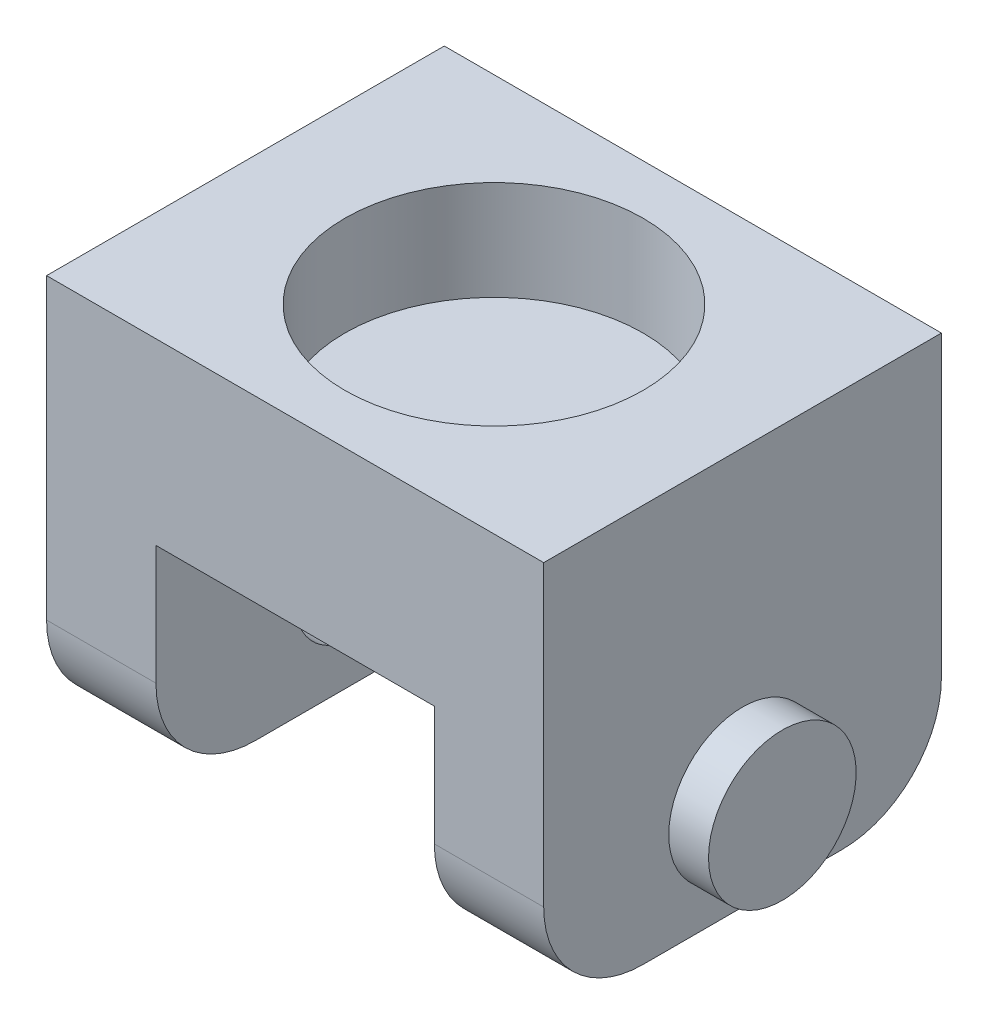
SolidWorks part; units mm, degrees
ref_plane "Alzado" through (0, 0, 0) normal (0, 0, 1) x (1, 0, 0)
ref_plane "Planta" through (0, 0, 0) normal (0, 1, 0) x (1, 0, 0)
ref_plane "Vista lateral" through (0, 0, 0) normal (1, 0, 0) x (0, 0, -1)
sketch "Croquis1" plane through (0, 0, 0) normal (0, 1, 0) x (1, 0, 0)
  line L1 (-12.5, 10) -> (12.5, 10)
  line L2 (-12.5, 10) -> (-12.5, -10)
  line L3 (-12.5, -10) -> (12.5, -10)
  line L4 (12.5, 10) -> (12.5, -10)
  line L5 (-12.5, 10) -> (12.5, -10) construction
  line L6 (-12.5, -10) -> (12.5, 10) construction
  point P0 (0, 0)
  dimension "D1" = 25
  dimension "D2" = 20
extrude "Saliente-Extruir1" add sketch "Croquis1" along normal blind 20
sketch "Croquis2" plane through (0, 20, 0) normal (0, 1, 0) x (1, 0, 0)
  circle A0 centre (0, 0) radius 7.5
  dimension "D1" = 15
extrude "Cortar-Extruir1" cut sketch "Croquis2" against normal blind 5
sketch "Croquis4" plane through (0, 0, 10) normal (0, 0, 1) x (1, 0, 0)
  line L1 (-12.5, 0) -> (12.5, 0) construction
  line L2 (-7, 11) -> (7, 11)
  line L3 (-7, 11) -> (-7, -11)
  line L4 (-7, -11) -> (7, -11)
  line L5 (7, 11) -> (7, -11)
  line L6 (-7, 11) -> (7, -11) construction
  line L7 (-7, -11) -> (7, 11) construction
  point P0 (0, 0)
  dimension "D1" = 14
  dimension "D2" = 22
extrude "Cortar-Extruir3" cut sketch "Croquis4" against normal through all
sketch "Croquis5" plane through (-12.5, 0, 0) normal (-1, 0, 0) x (0, 0, 1)
  line L0 (10, 5) -> (-10, 5) construction
  line L1 (10, 20) -> (10, 0) construction
  line L2 (-10, 20) -> (-10, 0) construction
  line L3 (-10, 0) -> (10, 0) construction
  circle A0 centre (0, 5) radius 3
  dimension "D1" = 6
  dimension "D2" = 5
extrude "Cortar-Extruir4" cut sketch "Croquis5" against normal through all
fillet "Redondeo1" radius 5 4 edges at (9.75, 0, -10) (9.75, 0, 10) (-9.75, 0, -10) (-9.75, 0, 10)
sketch "Croquis6" plane through (-12.5, 0, 0) normal (-1, 0, 0) x (0, 0, 1)
  circle A0 centre (0, 5) radius 3.7123
extrude "Saliente-Extruir2" add sketch "Croquis6" along normal blind 2
mirror "Simetría1" about plane through (0, 0, 0) normal (1, 0, 0) of "Saliente-Extruir2"
